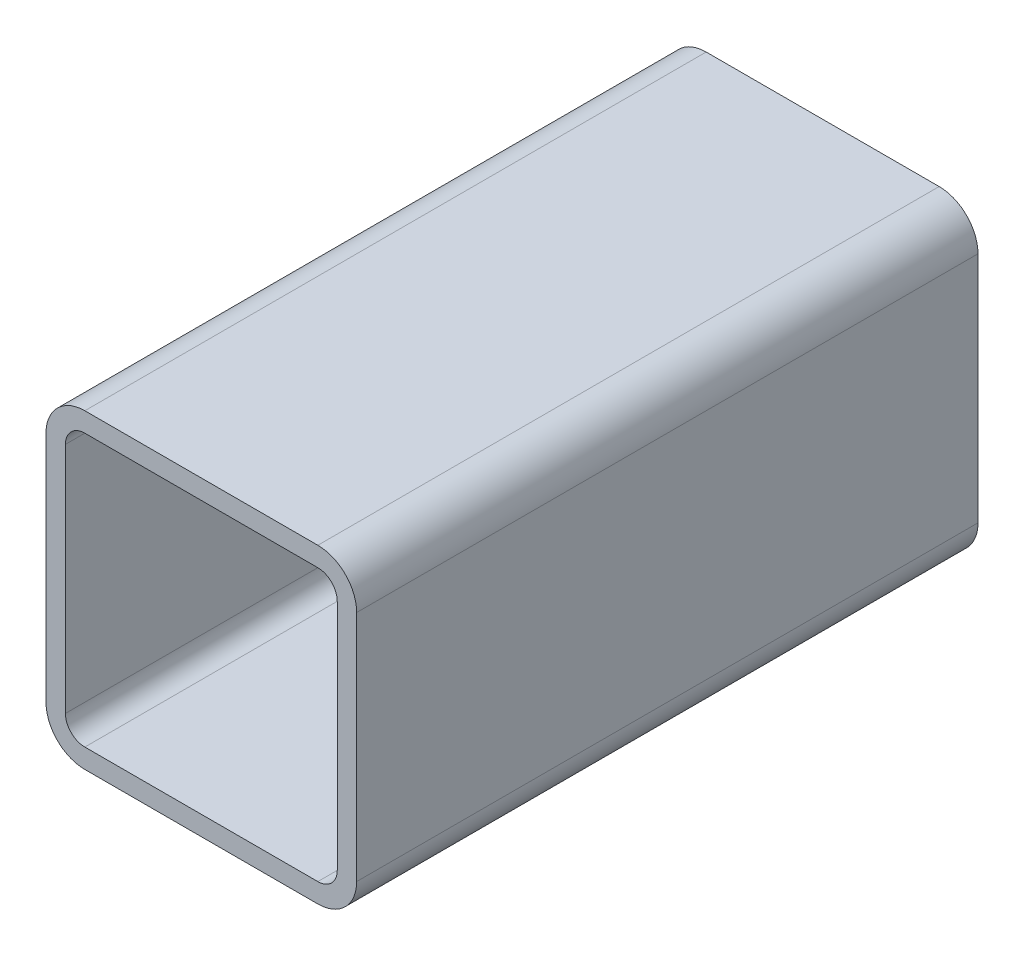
SolidWorks part; units mm, degrees
ref_plane "Front Plane" through (0, 0, 0) normal (0, 0, 1) x (1, 0, 0)
ref_plane "Top Plane" through (0, 0, 0) normal (0, 1, 0) x (1, 0, 0)
ref_plane "Right Plane" through (0, 0, 0) normal (1, 0, 0) x (0, 0, -1)
sketch "Sketch1" plane through (0, 0, 0) normal (0, 0, 1) x (1, 0, 0)
sketch_block_instance "HSS6x6x0.375-1"
sketch_block "HSS6x6x0.375"
extrude "Boss-Extrude1" add sketch "Sketch1" along normal blind 304.8
